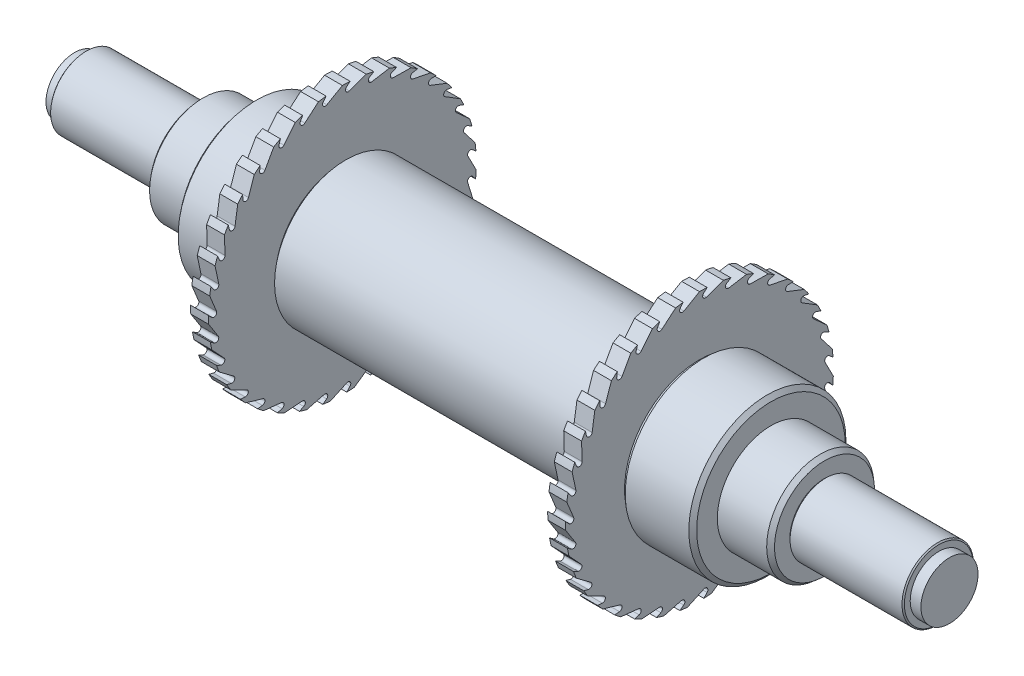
SolidWorks part; units mm, degrees
ref_plane "Front" through (0, 0, 0) normal (0, 0, 1) x (1, 0, 0)
ref_plane "Top" through (0, 0, 0) normal (0, 1, 0) x (1, 0, 0)
ref_plane "Right" through (0, 0, 0) normal (1, 0, 0) x (0, 0, -1)
sketch "Sketch1" plane through (0, 0, 0) normal (0, 0, 1) x (1, 0, 0)
  line L0 (122.5, 0) -> (151.2527, 0) construction
  line L1 (-122.5, 8) -> (-87.5, 8)
  line L2 (-122.5, 8) -> (-122.5, 0)
  line L3 (-122.5, 0) -> (122.5, 0)
  line L4 (122.5, 8) -> (122.5, 0)
  line L5 (0, 0) -> (0, 20) construction
  line L6 (87.5, 8) -> (122.5, 8)
  line L7 (47.5, 15) -> (87.5, 15)
  line L8 (-87.5, 8) -> (-87.5, 15)
  line L9 (-87.5, 15) -> (-47.5, 15)
  line L10 (87.5, 8) -> (87.5, 15)
  line L12 (-47.5, 15) -> (-47.5, 20)
  line L13 (-47.5, 20) -> (47.5, 20)
  line L14 (47.5, 15) -> (47.5, 20)
  dimension "D1" = 245
  dimension "D2" = 16
  dimension "D3" = 35
  dimension "D4" = 30
  dimension "D5" = 40
  dimension "D6" = 95
revolve "Revolve1" add sketch "Sketch1" angle 360 about L0
sketch "Sketch2" plane through (47.5, 0, 0) normal (1, 0, 0) x (0, 0, -1)
  circle A0 centre (0, 0) radius 15 construction
  circle A1 centre (0, 0) radius 15
  circle A2 centre (0, 0) radius 37.5
  dimension "D1" = 75
extrude "Boss-Extrude1" add sketch "Sketch2" along normal blind 5 separate body
sketch "Sketch3" plane through (52.5, 0, 0) normal (1, 0, 0) x (0, 0, -1)
  line L0 (0, 0) -> (0, 37.5) construction
  line L1 (0, 37.5) -> (-4.3635, 34.9808)
  line L2 (-5.3939, 36.1661) -> (-4.5701, 37.2205)
  line L3 (0, 0) -> (-4.5701, 37.2205) construction
  circle A0 centre (0, 0) radius 37.5 construction
  arc A1 (-4.3635, 34.9808) -> (-5.3939, 36.1661) centre (-4.7635, 35.6736) cw
  arc A2 (0, 37.5) -> (-4.5701, 37.2205) centre (0, 0) ccw
  dimension "D2" = 0.8
  dimension "D1" = 60
  dimension "D3" = 45
  dimension "D4" = 7
extrude "Cut-Extrude1" cut sketch "Sketch3" against normal through all
pattern_circular "CirPattern1" count 35 over 360 about axis through (0, 0, 0) along (1, 0, 0) of "Cut-Extrude1"
sketch "Sketch5" plane through (52.5, 0, 0) normal (1, 0, 0) x (0, 0, -1)
  circle A0 centre (0, 0) radius 15 construction
  circle A1 centre (0, 0) radius 15
  circle A2 centre (0, 0) radius 22
  dimension "D1" = 44
extrude "Boss-Extrude2" add sketch "Sketch5" along normal blind 20 separate body
sketch "Sketch6" plane through (87.5, 0, 0) normal (1, 0, 0) x (0, 0, -1)
  circle A0 centre (0, 0) radius 8 construction
  circle A1 centre (0, 0) radius 8
  circle A2 centre (0, 0) radius 10
  dimension "D1" = 20
extrude "Boss-Extrude3" add sketch "Sketch6" along normal blind 32 separate body
chamfer "Chamfer2" distance 1 angle 50 2 edges at (52.5, 0, -22) (72.5, 0, -22)
chamfer "Chamfer3" distance 0.3 angle 50 2 edges at (87.5, 0, -10) (119.5, 0, -10)
mirror "Mirror1" about plane through (0, 0, 0) normal (1, 0, 0)
chamfer "Chamfer1" distance 1 angle 50 4 edges at (-87.5, 0, 15) (87.5, 0, 15) (47.5, 0, 20) (-47.5, 0, 20)
